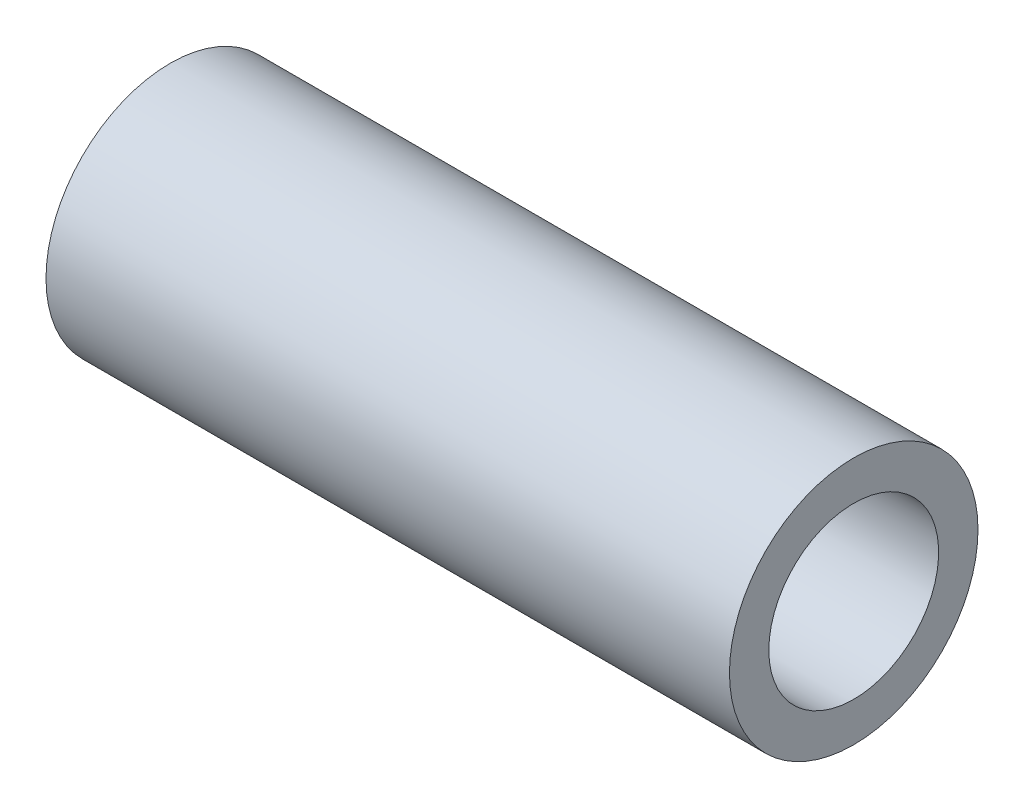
SolidWorks part; units mm, degrees
ref_plane "Plan de face" through (0, 0, 0) normal (0, 0, 1) x (1, 0, 0)
ref_plane "Plan de dessus" through (0, 0, 0) normal (0, 1, 0) x (1, 0, 0)
ref_plane "Plan de droite" through (0, 0, 0) normal (1, 0, 0) x (0, 0, -1)
sketch "Esquisse2" plane through (0, 0, 0) normal (-1, 0, 0) x (0, 0, 1)
  circle A0 centre (2, 380) radius 4.1
  circle A1 centre (2, 380) radius 6
  dimension "D1" = 8.2
  dimension "D2" = 12
extrude "Extrusion1" add sketch "Esquisse2" against normal mid plane 33
